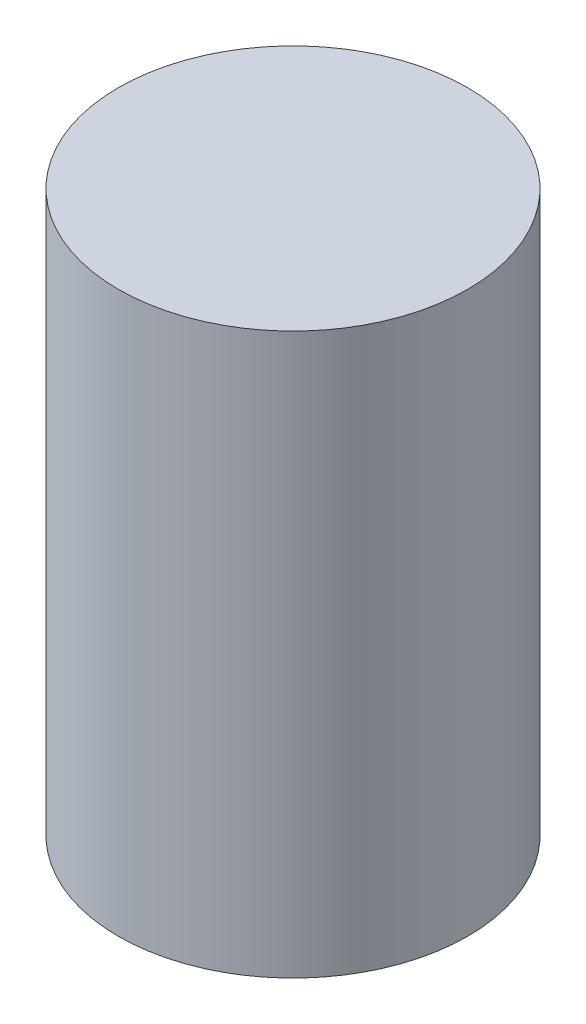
SolidWorks part; units mm, degrees
ref_plane "Front/Back" through (0, 0, 0) normal (0, 0, 1) x (1, 0, 0)
ref_plane "Top/Bottom" through (0, 0, 0) normal (0, 1, 0) x (1, 0, 0)
ref_plane "Right/Left" through (0, 0, 0) normal (1, 0, 0) x (0, 0, -1)
sketch "Sketch1" plane through (0, 0, 0) normal (0, 1, 0) x (1, 0, 0)
  circle A1 centre (0, 0) radius 1.5875
  dimension "D2" = 3.175
extrude "Extrude1" add sketch "Sketch1" along normal mid plane 5.0927
